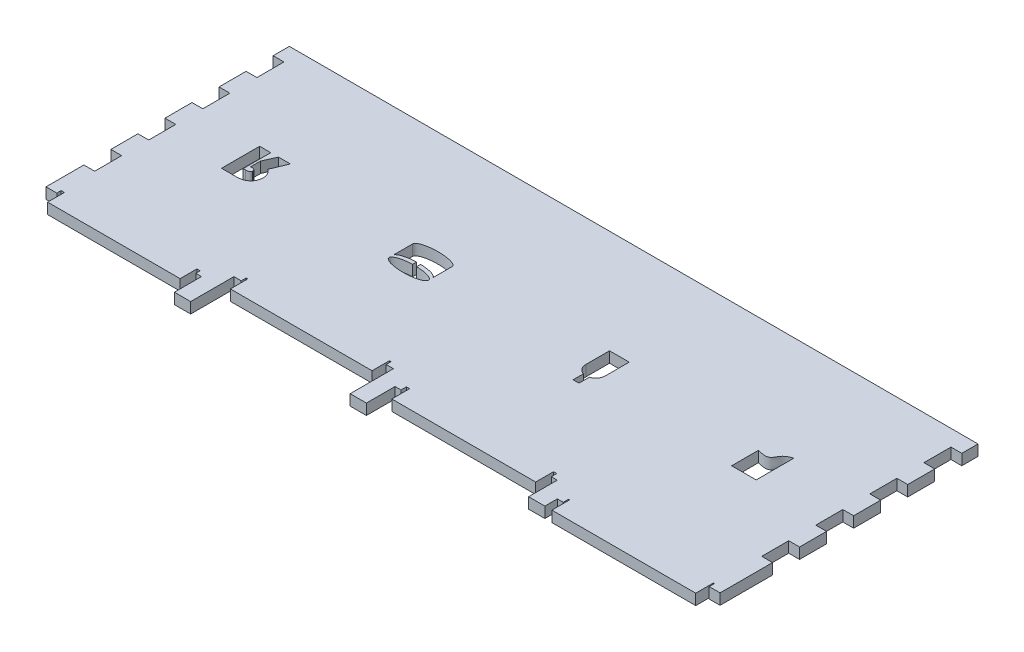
SolidWorks part; units mm, degrees
ref_plane "Front" through (0, 0, 0) normal (0, 0, 1) x (1, 0, 0)
ref_plane "Top" through (0, 0, 0) normal (0, 1, 0) x (1, 0, 0)
ref_plane "Right" through (0, 0, 0) normal (1, 0, 0) x (0, 0, -1)
sketch "Sketch1" plane through (0, 0, 0) normal (0, 1, 0) x (1, 0, 0)
  line L0 (1330, -162.7527) -> (-38.6401, -162.7527) construction
  line L1 (29.9516, 52.2473) -> (29.9516, 122.2473)
  line L2 (1303.4516, 25.2473) -> (1303.4516, 122.2473)
  line L3 (29.9516, 502.2473) -> (1303.4516, 502.2473)
  line L4 (666.7016, 502.2473) -> (666.7016, 300) construction
  line L5 (1303.4516, 472.2473) -> (1303.4516, 502.2473)
  line L6 (-120.3033, 337.2473) -> (1514.0331, 337.2473) construction
  line L7 (29.9516, 52.2473) -> (49.9516, 52.2473)
  line L8 (317.4516, 2.2473) -> (317.4516, 52.2473)
  line L9 (49.9516, 52.2473) -> (49.9516, 60.2473)
  line L10 (55.9516, 29.2473) -> (55.9516, 52.2473)
  line L11 (317.4516, 2.2473) -> (347.4516, 2.2473)
  line L12 (300.9516, 29.2473) -> (300.9516, 52.2473)
  line L13 (49.9516, 60.2473) -> (55.9516, 60.2473)
  line L14 (347.4516, 2.2473) -> (347.4516, 82.2473)
  line L15 (347.4516, 82.2473) -> (360.9516, 82.2473)
  line L16 (642.4516, 2.2473) -> (642.4516, 82.2473)
  line L17 (55.9516, 52.2473) -> (55.9516, 60.2473)
  line L18 (363.9516, 59.2473) -> (363.9516, 82.2473)
  line L19 (642.4516, 2.2473) -> (672.4516, 2.2473)
  line L20 (625.9516, 59.2473) -> (625.9516, 82.2473)
  line L21 (29.9516, 472.2473) -> (49.9516, 472.2473)
  line L22 (672.4516, 2.2473) -> (672.4516, 55.2473)
  line L23 (672.4516, 55.2473) -> (689.4516, 55.2473)
  line L24 (972.4516, 2.2473) -> (972.4516, 55.2473)
  line L25 (-84.5522, 112.2473) -> (1391.4578, 112.2473) construction
  line L26 (689.4516, 32.2473) -> (689.4516, 55.2473)
  line L27 (1015.4516, 2.2473) -> (1281.4516, 2.2473)
  line L28 (955.4516, 32.2473) -> (955.4516, 55.2473)
  line L29 (1015.4516, 2.2473) -> (1281.4516, 2.2473)
  line L30 (1002.4516, 2.2473) -> (1002.4516, 25.2473)
  line L31 (1002.4516, 25.2473) -> (1015.4516, 25.2473)
  line L32 (1283.4516, 422.2473) -> (1283.4516, 472.2473)
  line L33 (1015.4516, 2.2473) -> (1281.4516, 2.2473)
  line L34 (1015.4516, 2.2473) -> (1015.4516, 25.2473)
  line L35 (1303.4516, 372.2473) -> (1303.4516, 422.2473)
  line L36 (1281.4516, 2.2473) -> (1281.4516, 25.2473)
  line L37 (11.4516, 167.2473) -> (1303.4516, 167.2473) construction
  line L38 (11.4516, 392.2473) -> (1303.4516, 392.2473) construction
  line L39 (300.9516, 52.2473) -> (300.9516, 60.2473)
  line L40 (29.9516, 422.2473) -> (49.9516, 422.2473)
  line L41 (300.9516, 60.2473) -> (306.9516, 60.2473)
  line L42 (306.9516, 52.2473) -> (306.9516, 60.2473)
  line L43 (64.9516, -353.7206) -> (64.9516, 649.4869) construction
  line L44 (360.9516, 82.2473) -> (360.9516, 91.2473)
  line L45 (360.9516, 91.2473) -> (363.9516, 91.2473)
  line L46 (363.9516, 82.2473) -> (363.9516, 91.2473)
  line L47 (29.9516, 502.2473) -> (1367.9516, 502.2473) construction
  line L48 (625.9516, 82.2473) -> (625.9516, 91.2473)
  line L49 (29.9516, 372.2473) -> (49.9516, 372.2473)
  line L50 (306.9516, 52.2473) -> (317.4516, 52.2473)
  line L51 (625.9516, 91.2473) -> (628.9516, 91.2473)
  line L52 (628.9516, 82.2473) -> (628.9516, 91.2473)
  line L53 (689.4516, 55.2473) -> (683.4516, 55.2473)
  line L54 (689.4516, 55.2473) -> (689.4516, 65.2473)
  line L55 (29.9516, 322.2473) -> (49.9516, 322.2473)
  line L56 (628.9516, 82.2473) -> (642.4516, 82.2473)
  line L57 (972.4516, 2.2473) -> (1002.4516, 2.2473)
  line L58 (955.4516, 55.2473) -> (972.4516, 55.2473)
  line L59 (1281.4516, 25.2473) -> (1303.4516, 25.2473)
  line L60 (55.9516, 29.2473) -> (300.9516, 29.2473)
  line L61 (363.9516, 59.2473) -> (625.9516, 59.2473)
  line L62 (689.4516, 32.2473) -> (955.4516, 32.2473)
  line L63 (29.9516, 272.2473) -> (49.9516, 272.2473)
  line L64 (29.9516, 222.2473) -> (49.9516, 222.2473)
  line L65 (29.9516, 172.2473) -> (49.9516, 172.2473)
  line L66 (29.9516, 122.2473) -> (49.9516, 122.2473)
  line L67 (29.9516, 172.2473) -> (29.9516, 222.2473)
  line L68 (49.9516, 122.2473) -> (49.9516, 172.2473)
  line L69 (49.9516, 222.2473) -> (49.9516, 272.2473)
  line L70 (29.9516, 272.2473) -> (29.9516, 322.2473)
  line L71 (49.9516, 322.2473) -> (49.9516, 372.2473)
  line L72 (29.9516, 372.2473) -> (29.9516, 422.2473)
  line L73 (49.9516, 422.2473) -> (49.9516, 472.2473)
  line L74 (29.9516, 472.2473) -> (29.9516, 502.2473)
  line L75 (689.4516, 65.2473) -> (683.4516, 65.2473)
  line L76 (683.4516, 55.2473) -> (683.4516, 65.2473)
  line L77 (955.4516, 55.2473) -> (961.4516, 55.2473)
  line L78 (955.4516, 55.2473) -> (955.4516, 65.2473)
  line L79 (955.4516, 65.2473) -> (961.4516, 65.2473)
  line L80 (961.4516, 55.2473) -> (961.4516, 65.2473)
  line L81 (1015.4516, 25.2473) -> (1013.4516, 25.2473)
  line L82 (1015.4516, 25.2473) -> (1015.4516, 35.2473)
  line L83 (1015.4516, 35.2473) -> (1013.4516, 35.2473)
  line L84 (1013.4516, 25.2473) -> (1013.4516, 35.2473)
  line L85 (1281.4516, 25.2473) -> (1283.4516, 25.2473)
  line L86 (1281.4516, 25.2473) -> (1281.4516, 35.2473)
  line L87 (1281.4516, 35.2473) -> (1283.4516, 35.2473)
  line L88 (1283.4516, 25.2473) -> (1283.4516, 35.2473)
  line L89 (1283.4516, 322.2473) -> (1283.4516, 372.2473)
  line L90 (1303.4516, 272.2473) -> (1303.4516, 322.2473)
  line L91 (1283.4516, 222.2473) -> (1283.4516, 272.2473)
  line L92 (1283.4516, 122.2473) -> (1283.4516, 172.2473)
  line L93 (1303.4516, 172.2473) -> (1303.4516, 222.2473)
  line L94 (1303.4516, 122.2473) -> (1283.4516, 122.2473)
  line L95 (1303.4516, 172.2473) -> (1283.4516, 172.2473)
  line L96 (1303.4516, 222.2473) -> (1283.4516, 222.2473)
  line L97 (1303.4516, 272.2473) -> (1283.4516, 272.2473)
  line L98 (1303.4516, 322.2473) -> (1283.4516, 322.2473)
  line L99 (1303.4516, 372.2473) -> (1283.4516, 372.2473)
  line L100 (1303.4516, 422.2473) -> (1283.4516, 422.2473)
  line L101 (1303.4516, 472.2473) -> (1283.4516, 472.2473)
  line L102 (1303.4516, 472.2473) -> (1303.4516, 502.2473)
  line L103 (1303.4516, 372.2473) -> (1303.4516, 422.2473)
  line L104 (1303.4516, 272.2473) -> (1303.4516, 322.2473)
  line L105 (1303.4516, 172.2473) -> (1303.4516, 222.2473)
  line L106 (29.9516, 502.2473) -> (29.9516, -254.276) construction
  line L107 (29.9516, -254.276) -> (1367.9516, -254.276) construction
  line L108 (1367.9516, 502.2473) -> (1367.9516, -254.276) construction
  line L109 (1332.9516, -353.7206) -> (1332.9516, 686.3019) construction
  dimension "D4" = 6
  dimension "D5" = 16.5
  dimension "D6" = 295
  dimension "D7" = 16.5
  dimension "D8" = 16.5
  dimension "D9" = 17
  dimension "D10" = 17
  dimension "D11" = 300
  dimension "D12" = 8
  dimension "D13" = 30
  dimension "D14" = 30
  dimension "D15" = 266
  dimension "D16" = 30
  dimension "D17" = 13
  dimension "D18" = 500
  dimension "D19" = 188
  dimension "D20" = 245
  dimension "D21" = 215
  dimension "D22" = 218
  dimension "D23" = 30
  dimension "D24" = 192
  dimension "D25" = 9
  dimension "D26" = 9
  dimension "D27" = 23
  dimension "D28" = 23
  dimension "D29" = 23
  dimension "D30" = 3
  dimension "D31" = 3
  dimension "D32" = 6
  dimension "D33" = 10
  dimension "D34" = 6
  dimension "D35" = 10
  dimension "D36" = 10
  dimension "D37" = 2
  dimension "D38" = 10
  dimension "D39" = 2
  dimension "D40" = 20
  dimension "D41" = 245
  dimension "D42" = 20
  dimension "D43" = 165
  dimension "D44" = 390
  dimension "D45" = 165
  dimension "D46" = 390
  dimension "D47" = 1338
  dimension "D48" = 756.5233
  dimension "D49" = 35
  dimension "D50" = 35
extrude "Extrude1" add sketch "Sketch1" along normal blind 20 contours L101 L5 L3 L74 L21 L73 L40 L72 L49 L71 L55 L70 L63 L69 L64 L67 L65 L68 L66 L1 L7 L9 L13 L17 L10 L60 L12 L39 L41 L42 L50 L8 L11 L14 L15 L44 L45 L46 L18 L61 L20 L48 L51 L52 L56 L16 L19 L22 L23 L76 L75
sketch "Sketch2"
extrude "Extrude2" cut sketch "Sketch2" against normal through all
